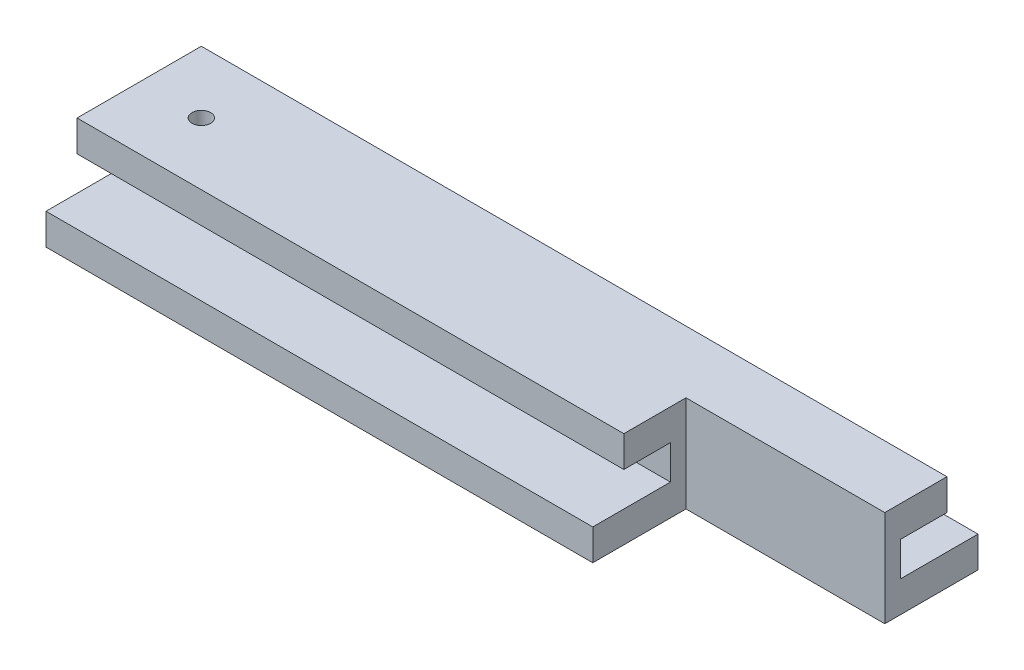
SolidWorks part; units mm, degrees
ref_plane "Front Plane" through (0, 0, 0) normal (0, 0, 1) x (1, 0, 0)
ref_plane "Top Plane" through (0, 0, 0) normal (0, 1, 0) x (1, 0, 0)
ref_plane "Right Plane" through (0, 0, 0) normal (1, 0, 0) x (0, 0, -1)
sketch "Sketch1" plane through (0, 0, 0) normal (1, 0, 0) x (0, 0, -1)
  line L1 (-15, -2.5) -> (15, -2.5)
  line L2 (-15, -2.5) -> (-15, 2.5)
  line L3 (-15, 2.5) -> (15, 2.5)
  line L4 (15, -2.5) -> (15, 2.5)
  line L5 (-15, -2.5) -> (15, 2.5) construction
  line L6 (-15, 2.5) -> (15, -2.5) construction
  point P0 (0, 0)
  dimension "D1" = 5
  dimension "D2" = 30
extrude "Boss-Extrude1" add sketch "Sketch1" along normal blind 120 contours L2 L1 L4 L3
sketch "Sketch2" plane through (0, 2.5, 0) normal (0, 1, 0) x (1, 0, 0)
  line L0 (0, -15) -> (0, 15) construction
  line L1 (0, -2.5) -> (120, -2.5)
  line L2 (0, -2.5) -> (0, 2.5)
  line L3 (0, 2.5) -> (120, 2.5)
  line L4 (120, -2.5) -> (120, 2.5)
  line L5 (120, -15) -> (120, 15) construction
  line L6 (60, -2.5) -> (60, 15)
  line L7 (120, 15) -> (0, 15) construction
  line L8 (60, 2.5) -> (60, -15)
  line L9 (120, -15) -> (0, -15) construction
  dimension "D1" = 5
extrude "Boss-Extrude2" add sketch "Sketch2" along normal blind 10.5 contours L2 L1 L4 L3
sketch "Sketch3" plane through (0, 0, 2.5) normal (0, 0, 1) x (1, 0, 0)
  line L0 (120, 13) -> (120, 2.5) construction
  line L1 (0, 13) -> (120, 13)
  line L2 (0, 13) -> (0, 8)
  line L3 (0, 8) -> (120, 8)
  line L4 (120, 13) -> (120, 8)
  dimension "D1" = 5
extrude "Boss-Extrude3" add sketch "Sketch3" along normal blind 7.5 contours L2 L1 L4 L3
sketch "Sketch4" plane through (0, 0, -2.5) normal (0, 0, -1) x (-1, 0, 0)
  line L0 (0, 13) -> (0, 2.5) construction
  line L1 (-120, 13) -> (0, 13)
  line L2 (-120, 13) -> (-120, 8)
  line L3 (-120, 8) -> (0, 8)
  line L4 (0, 13) -> (0, 8)
  dimension "D1" = 5
extrude "Boss-Extrude4" add sketch "Sketch4" along normal blind 7.5 contours L2 L1 L4 L3
sketch "Sketch5" plane through (0, -2.5, 0) normal (0, -1, 0) x (1, 0, 0)
  line L1 (120, 15) -> (88, 15)
  line L2 (120, 15) -> (120, 0)
  line L3 (120, 0) -> (88, 0)
  line L4 (88, 15) -> (88, 0)
  dimension "D1" = 32
  dimension "D2" = 15
extrude "Cut-Extrude1" cut sketch "Sketch5" against normal through all contours L2 L1 L4 L3
sketch "Sketch6" plane through (0, 13, 0) normal (0, 1, 0) x (1, 0, 0)
  line L0 (0, 0) -> (88, 0) construction
  circle A0 centre (10, 0) radius 1.5
  point P6 (0, 0)
  point P7 (0, 0)
  dimension "D1" = 3
  dimension "D2" = 10
extrude "Cut-Extrude2" cut sketch "Sketch6" against normal through all
